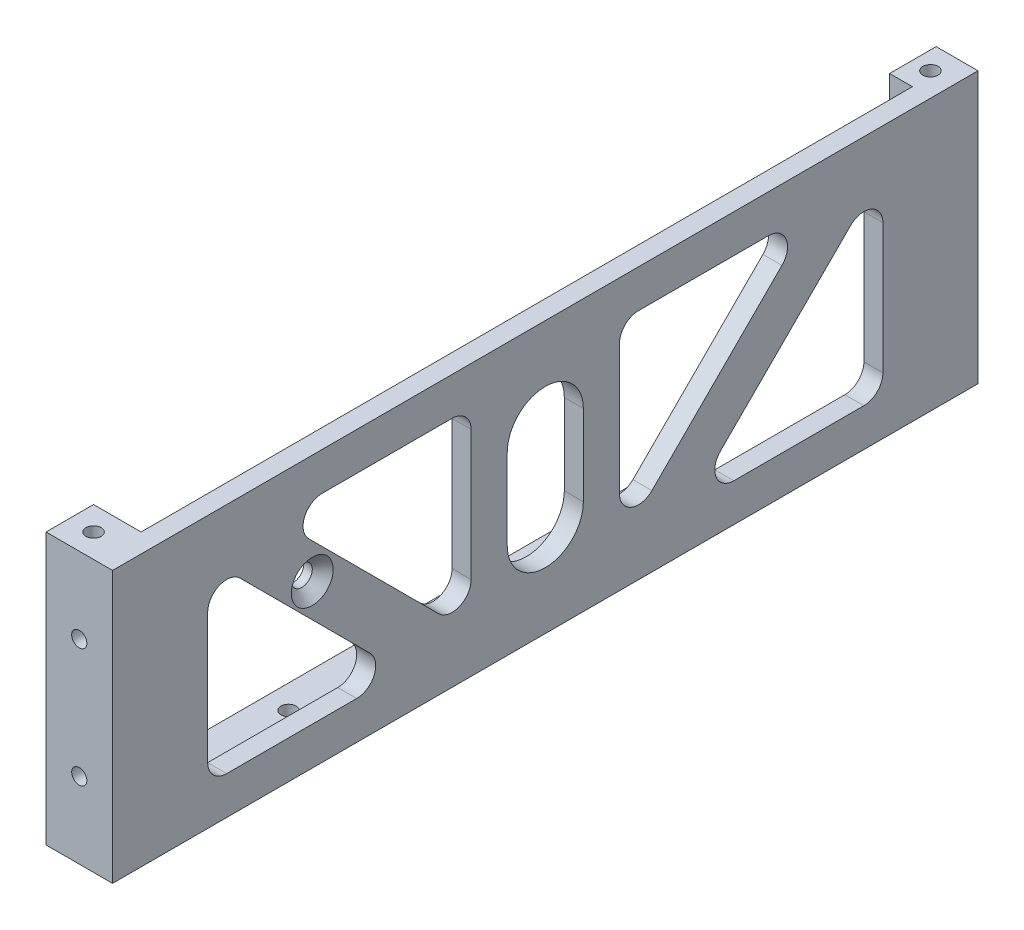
SolidWorks part; units mm, degrees
ref_plane "Front Plane" through (0, 0, 0) normal (0, 0, 1) x (1, 0, 0)
ref_plane "Top Plane" through (0, 0, 0) normal (0, 1, 0) x (1, 0, 0)
ref_plane "Right Plane" through (0, 0, 0) normal (1, 0, 0) x (0, 0, -1)
sketch "Sketch1" plane through (0, 0, 0) normal (1, 0, 0) x (0, 0, -1)
  line L1 (45.5, 14.25) -> (-45.5, 14.25)
  line L2 (45.5, 14.25) -> (45.5, -14.25)
  line L3 (45.5, -14.25) -> (-45.5, -14.25)
  line L4 (-45.5, 14.25) -> (-45.5, -14.25)
  line L5 (45.5, 14.25) -> (-45.5, -14.25) construction
  line L6 (45.5, -14.25) -> (-45.5, 14.25) construction
  point P0 (0, 0)
  dimension "D1" = 91
  dimension "D2" = 28.5
extrude "Boss-Extrude1" add sketch "Sketch1" along normal blind 2
sketch "Sketch2" plane through (0, 0, 0) normal (-1, 0, 0) x (0, 0, 1)
  line L0 (45.5, -14.25) -> (-45.5, -14.25) construction
  line L1 (-45.5, 14.25) -> (-40.6, 14.25)
  line L2 (-45.5, 14.25) -> (-45.5, -14.25)
  line L3 (-45.5, -14.25) -> (-40.6, -14.25)
  line L4 (-40.6, 14.25) -> (-40.6, -14.25)
  dimension "D1" = 4.9
extrude "Boss-Extrude2" add sketch "Sketch2" along normal blind 2.4
sketch "Sketch3" plane through (0, 0, 0) normal (-1, 0, 0) x (0, 0, 1)
  line L0 (45.5, -14.25) -> (-40.6, -14.25) construction
  line L1 (-20.5, -14.25) -> (45.5, -14.25)
  line L2 (-20.5, -14.25) -> (-20.5, -12.25)
  line L3 (-20.5, -12.25) -> (40.5, -12.25)
  line L4 (45.5, -14.25) -> (45.5, -11.25)
  line L5 (-45.5, 14.25) -> (-45.5, -14.25) construction
  line L6 (45.5, 14.25) -> (45.5, -14.25) construction
  line L8 (45.5, 14.25) -> (40.5, 14.25)
  line L9 (45.5, 14.25) -> (45.5, -11.25)
  line L11 (40.5, 14.25) -> (40.5, -12.25)
  dimension "D1" = 25
  dimension "D2" = 2
  dimension "D3" = 5
extrude "Boss-Extrude3" add sketch "Sketch3" along normal blind 5
sketch "Sketch9" plane through (0, -12.25, 0) normal (0, 1, 0) x (1, 0, 0)
  line L1 (-5, -34.5) -> (-2, -34.5)
  line L2 (0, -40.5) -> (0, 20.5) construction
  line L3 (-5, -40.5) -> (-5, -34.5)
  line L4 (0, -36.5) -> (0, -38.5)
  line L5 (-2, -40.5) -> (-5, -40.5)
  arc A0 (0, -38.5) -> (-2, -40.5) centre (-2, -38.5) cw
  arc A1 (-2, -34.5) -> (0, -36.5) centre (-2, -36.5) cw
  point P8 (0, -40.5)
  point P11 (0, -34.5)
  dimension "D2" = 2
  dimension "D1" = 6
extrude "Cut-Extrude1" cut sketch "Sketch9" against normal blind 5
fillet "Fillet1" radius 2 1 edges at (-1, -12.25, 40.5)
hole_wizard "M2 Tapped Hole1" positions "Sketch11" profile "Sketch10" tap size "M2" standard "ISO"
sketch "Sketch11" plane through (0, -14.25, 0) normal (0, -1, 0) x (-1, 0, 0)
  line L0 (-2, -45.5) -> (-2, 45.5) construction
  line L1 (-2, -45.5) -> (5, -45.5) construction
  line L2 (-2, 45.5) -> (2.4, 45.5) construction
  point P0 (2.5, -43)
  point P2 (0.5, 43)
  dimension "D1" = 4.5
  dimension "D2" = 2.5
  dimension "D3" = 2.5
  dimension "D4" = 2.5
sketch "Sketch10" plane through (-2.5, -14.25, 43) normal (1, 0, 0) x (0, 0, -1)
  line L0 (0, 0) -> (0, 5.6807)
  line L1 (0, 5.6807) -> (0.8, 5.2)
  line L2 (0.8, 5.2) -> (0.8, 0)
  line L5 (0.8, 0) -> (0, 0)
  line L10 (0, 5.6807) -> (-0.8, 5.2) construction
  line L11 (0, -6.35) -> (0, 107.95) construction
  dimension "Tap Drill Dia." = 1.6
  dimension "Tap Drill Depth" = 5.2
  dimension "Drill Angle" = 118
mirror "Mirror1" about plane through (0, 0, 0) normal (0, 1, 0) of "M2 Tapped Hole1"
hole_wizard "M2 Tapped Hole2" positions "Sketch15" profile "Sketch14" tap size "M2" standard "ISO"
sketch "Sketch15" plane through (0, 0, 45.5) normal (0, 0, 1) x (1, 0, 0)
  line L0 (2, 14.25) -> (2, -14.25) construction
  line L1 (2, -14.25) -> (-5, -14.25) construction
  line L2 (2, 14.25) -> (-5, 14.25) construction
  point P0 (-1.5, 6.25)
  point P2 (-1.5, -6.25)
  dimension "D1" = 3.5
  dimension "D2" = 3.5
  dimension "D3" = 8
  dimension "D4" = 8
sketch "Sketch14" plane through (-1.5, 6.25, 45.5) normal (1, 0, 0) x (0, -1, 0)
  line L0 (0, 0) -> (0, 5.6807)
  line L1 (0, 5.6807) -> (0.8, 5.2)
  line L2 (0.8, 5.2) -> (0.8, 0)
  line L5 (0.8, 0) -> (0, 0)
  line L10 (0, 5.6807) -> (-0.8, 5.2) construction
  line L11 (0, -6.35) -> (0, 107.95) construction
  dimension "Tap Drill Dia." = 1.6
  dimension "Tap Drill Depth" = 5.2
  dimension "Drill Angle" = 118
hole_wizard "M2 Tapped Hole3" positions "Sketch17" profile "Sketch16" tap size "M2" standard "ISO"
sketch "Sketch17" plane through (0, 0, -45.5) normal (0, 0, -1) x (-1, 0, 0)
  line L0 (-2, -14.25) -> (-2, 14.25) construction
  line L1 (-2, 14.25) -> (2.4, 14.25) construction
  line L2 (-2, -14.25) -> (2.4, -14.25) construction
  point P0 (1, 6.25)
  point P2 (1, -6.25)
  dimension "D1" = 3
  dimension "D2" = 3
  dimension "D3" = 8
  dimension "D4" = 8
sketch "Sketch16" plane through (-1, 6.25, -45.5) normal (1, 0, 0) x (0, 1, 0)
  line L0 (0, 0) -> (0, 5.6807)
  line L1 (0, 5.6807) -> (0.8, 5.2)
  line L2 (0.8, 5.2) -> (0.8, 0)
  line L5 (0.8, 0) -> (0, 0)
  line L10 (0, 5.6807) -> (-0.8, 5.2) construction
  line L11 (0, -6.35) -> (0, 107.95) construction
  dimension "Tap Drill Dia." = 1.6
  dimension "Tap Drill Depth" = 5.2
  dimension "Drill Angle" = 118
hole_wizard "CSK for M2 Countersunk Flat Head Screw1" positions "Sketch19" profile "Sketch18" countersink size "M2" standard "ISO"
sketch "Sketch19" plane through (2, 0, 0) normal (1, 0, 0) x (0, 0, -1)
  line L0 (45.5, -14.25) -> (45.5, 14.25) construction
  line L1 (-45.5, -14.25) -> (45.5, -14.25) construction
  point P0 (-24.5, 2.75)
  point P3 (45.5, 0)
  dimension "D1" = 70
  dimension "D2" = 17
sketch "Sketch18" plane through (2, 2.75, 24.5) normal (0, 1, 0) x (0, 0, -1)
  line L0 (0, 0) -> (0, 7)
  line L1 (0, 7) -> (1.1, 7)
  line L2 (1.1, 7) -> (1.1, 1.1)
  line L3 (1.1, 1.1) -> (2.2, 0)
  line L5 (2.2, 0) -> (0, 0)
  line L6 (-1.1, 1.1) -> (-2.2, 0) construction
  line L11 (0, -6.35) -> (0, 107.95) construction
  dimension "Thru Hole Dia." = 2.2
  dimension "Thru Hole Depth" = 7
  dimension "Near C'Sink Dia." = 4.4
  dimension "Near C'Sink Angle" = 90
sketch "Sketch20" plane through (2, 0, 0) normal (1, 0, 0) x (0, 0, -1)
  line L0 (-35.5, 5.4216) -> (-35.5, -8.25)
  line L1 (-33.5, -10.25) -> (-19.8284, -10.25)
  line L2 (-18.4142, -6.8358) -> (-32.0858, 6.8358)
  line L3 (-24.8858, 6.8358) -> (-11.2142, -6.8358)
  line L4 (-7.8, -5.4216) -> (-7.8, 8.25)
  line L5 (-9.8, 10.25) -> (-23.4716, 10.25)
  line L6 (-45.5, 14.25) -> (-45.5, -14.25) construction
  line L7 (45.5, 14.25) -> (-45.5, 14.25) construction
  line L8 (-45.5, -14.25) -> (45.5, -14.25) construction
  arc A0 (-7.8, 8.25) -> (-9.8, 10.25) centre (-9.8, 8.25) ccw
  arc A1 (-24.8858, 6.8358) -> (-23.4716, 10.25) centre (-23.4716, 8.25) cw
  arc A2 (-11.2142, -6.8358) -> (-7.8, -5.4216) centre (-9.8, -5.4216) ccw
  arc A3 (-19.8284, -10.25) -> (-18.4142, -6.8358) centre (-19.8284, -8.25) ccw
  arc A4 (-35.5, -8.25) -> (-33.5, -10.25) centre (-33.5, -8.25) ccw
  arc A5 (-35.5, 5.4216) -> (-32.0858, 6.8358) centre (-33.5, 5.4216) cw
  point P16 (-28.3, 10.25)
  point P19 (-7.8, -10.25)
  point P26 (-35.5, 10.25)
  dimension "D8" = 2
  dimension "D1" = 10
  dimension "D2" = 4
  dimension "D3" = 4
  dimension "D4" = 45
  dimension "D5" = 7.2
  dimension "D6" = 4
  dimension "D7" = 4
extrude "Cut-Extrude2" cut sketch "Sketch20" against normal blind 10
mirror "Mirror2" about plane through (0, 0, 0) normal (0, 0, 1) of "Cut-Extrude2"
sketch "Sketch22" plane through (2, 0, 0) normal (1, 0, 0) x (0, 0, -1)
  line L0 (0, 4.25) -> (0, -4.25) construction
  line L1 (4, 4.25) -> (4, -4.25)
  line L2 (-4, 4.25) -> (-4, -4.25)
  line L3 (45.5, 14.25) -> (-45.5, 14.25) construction
  line L4 (-45.5, -14.25) -> (45.5, -14.25) construction
  arc A0 (4, 4.25) -> (-4, 4.25) centre (0, 4.25) ccw
  arc A1 (-4, -4.25) -> (4, -4.25) centre (0, -4.25) ccw
  point P3 (0, 0)
  dimension "D1" = 4
  dimension "D2" = 10
  dimension "D3" = 10
extrude "Cut-Extrude3" cut sketch "Sketch22" against normal blind 10
hole_wizard "M2 Tapped Hole4" positions "Sketch24" profile "Sketch23" tap size "M2" standard "ISO"
sketch "Sketch24" plane through (0, -14.25, 0) normal (0, -1, 0) x (-1, 0, 0)
  line L0 (-2, -45.5) -> (5.1, -45.5) construction
  line L1 (5, 20.5) -> (5, -34.5) construction
  point P0 (2.5, -22.5)
  point P2 (2.5, 12.5)
  dimension "D1" = 23
  dimension "D2" = 35
  dimension "D3" = 2.5
  dimension "D4" = 2.5
sketch "Sketch23" plane through (-2.5, -14.25, 22.5) normal (1, 0, 0) x (0, 0, -1)
  line L0 (0, 0) -> (0, 28.5001)
  line L1 (0, 28.5001) -> (0.8, 28.5001)
  line L2 (0.8, 28.5001) -> (0.8, 0)
  line L5 (0.8, 0) -> (0, 0)
  line L11 (0, -6.35) -> (0, 107.95) construction
  dimension "Thru Tap Drill Dia." = 1.6
  dimension "Thru Tap Drill Depth" = 28.5001
